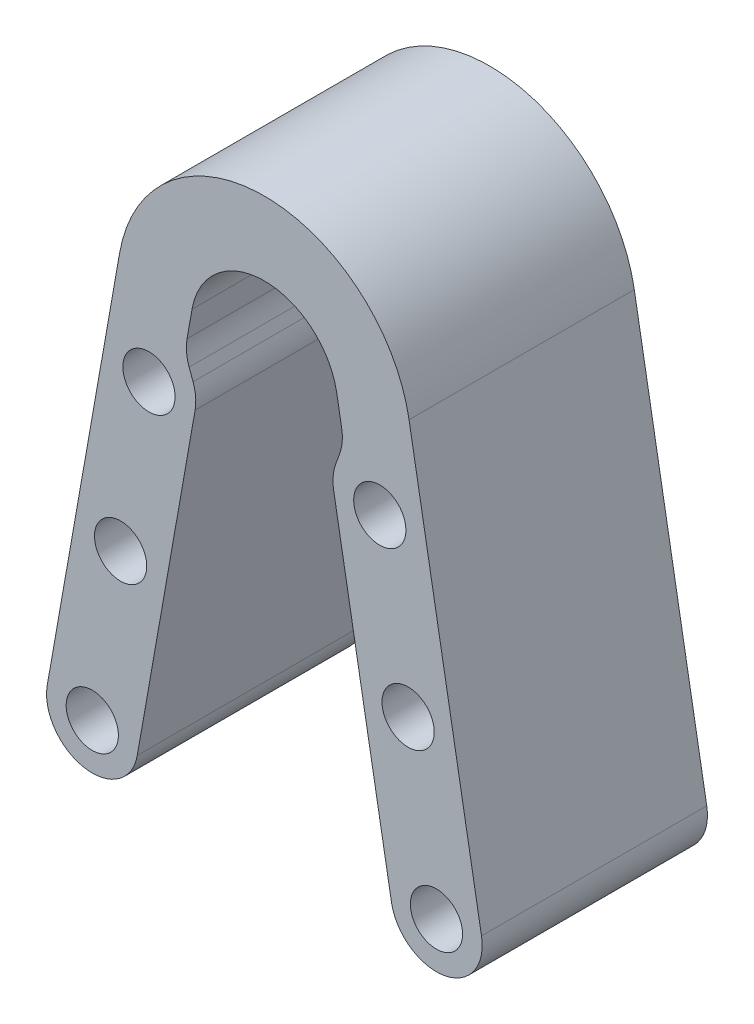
SolidWorks part; units mm, degrees
ref_plane "前视基准面" through (0, 0, 0) normal (0, 0, 1) x (1, 0, 0)
ref_plane "上视基准面" through (0, 0, 0) normal (0, 1, 0) x (1, 0, 0)
ref_plane "右视基准面" through (0, 0, 0) normal (1, 0, 0) x (0, 0, -1)
other "Configuration Table"
sketch "草图1" plane through (0, 0, 0) normal (0, 0, 1) x (1, 0, 0)
  line L0 (0, 0) -> (0, 61.0585) construction
  line L1 (4.4316, 0.7814) -> (4.8658, -1.6806)
  line L2 (4.8658, -1.6806) -> (4.1133, -3.7479)
  line L3 (4.1133, -3.7479) -> (7.786, -24.5769)
  line L4 (13.3009, -23.6044) -> (8.8633, 1.5628)
  line L5 (10.5435, -24.0906) -> (8.807, -14.2426) construction
  line L6 (-13.3009, -23.6044) -> (-8.8633, 1.5628)
  line L7 (-4.1133, -3.7479) -> (-7.786, -24.5769)
  line L8 (-4.4316, 0.7814) -> (-4.8658, -1.6806)
  line L9 (-4.8658, -1.6806) -> (-4.1133, -3.7479)
  arc A0 (7.786, -24.5769) -> (13.3009, -23.6044) centre (10.5435, -24.0906) ccw
  circle A1 centre (10.5435, -24.0906) radius 1.6
  arc A4 (-7.786, -24.5769) -> (-13.3009, -23.6044) centre (-10.5435, -24.0906) cw
  arc A8 (-4.4316, 0.7814) -> (4.4316, 0.7814) centre (0, 0) cw
  arc A9 (-8.8633, 1.5628) -> (8.8633, 1.5628) centre (0, 0) cw
  circle A10 centre (8.807, -14.2426) radius 1.6
  circle A11 centre (7.0705, -4.3945) radius 1.6
  circle A12 centre (-7.0705, -4.3945) radius 1.6
  circle A13 centre (-8.807, -14.2426) radius 1.6
  circle A14 centre (-10.5435, -24.0906) radius 1.6
  point P8 (11.0231, -23.1239)
  point P14 (5.5944, -0.643)
  point P24 (0, 0)
  point P34 (4.8036, -0.5404)
  point P35 (0, 0)
  point P36 (3.4723, -17.5531)
  dimension "D3" = 3.2
  dimension "D4" = 2.8
  dimension "D8" = 9
  dimension "D2" = 10
  dimension "D5" = 3
  dimension "D6" = 10
  dimension "D7" = 4.5
  dimension "D9" = 150
  dimension "D10" = 2.5
  dimension "D1" = 3
extrude "凸台-拉伸1" add sketch "草图1" along normal mid plane 13.8
fillet "圆角1" radius 2.8 4 edges at (4.8658, -1.6806, 0) (-4.8658, -1.6806, 0) (-4.1133, -3.7479, 0) (4.1133, -3.7479, 0)
